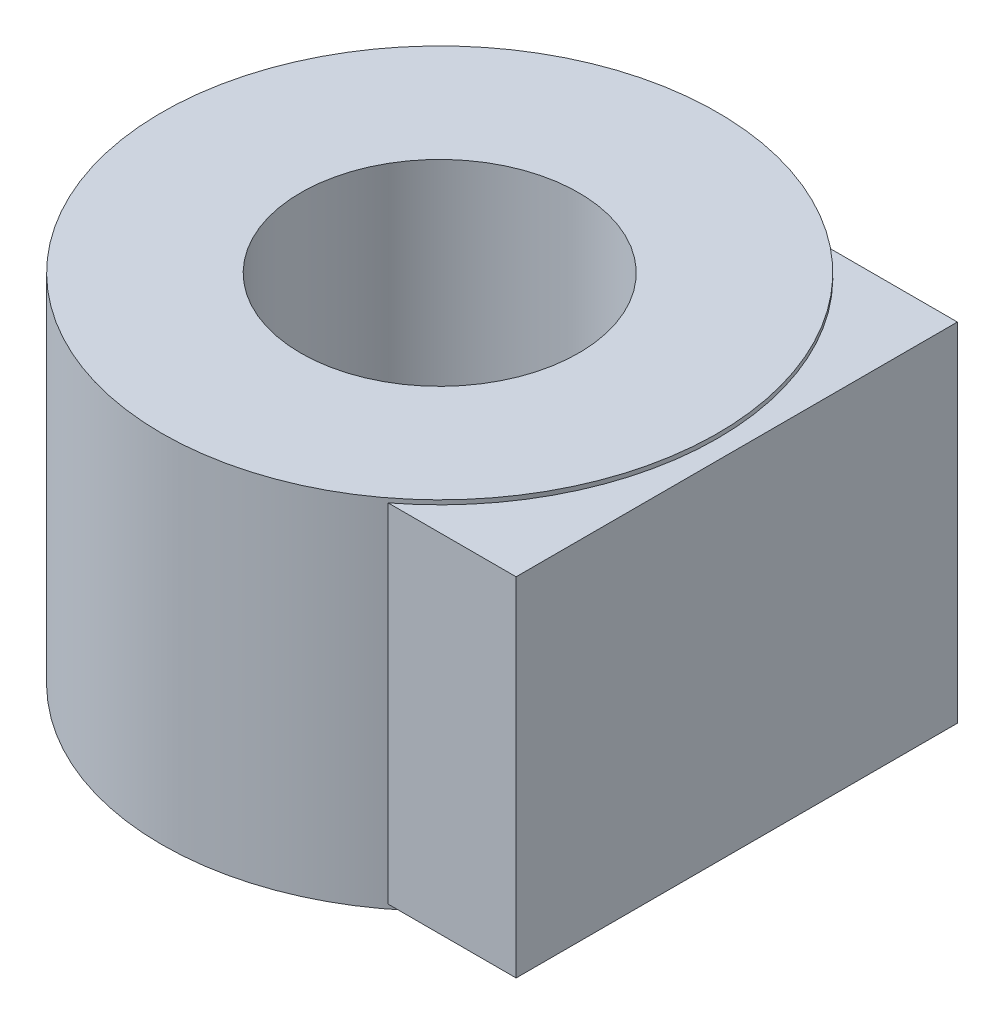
SolidWorks part; units mm, degrees
ref_plane "Front Plane" through (0, 0, 0) normal (0, 0, 1) x (1, 0, 0)
ref_plane "Top Plane" through (0, 0, 0) normal (0, 1, 0) x (1, 0, 0)
ref_plane "Right Plane" through (0, 0, 0) normal (1, 0, 0) x (0, 0, -1)
sketch "Sketch1" plane through (0, 0, 0) normal (0, 0, 1) x (1, 0, 0)
  line L1 (-18, -10) -> (18, -10)
  line L2 (-18, -10) -> (-18, 10)
  line L3 (-18, 10) -> (18, 10)
  line L4 (18, -10) -> (18, 10)
  line L5 (-18, -10) -> (18, 10) construction
  line L6 (-18, 10) -> (18, -10) construction
  point P0 (0, 0)
  dimension "D1" = 20
  dimension "D2" = 36
extrude "Boss-Extrude1" add sketch "Sketch1" along normal mid plane 25.4
sketch "Sketch2" plane through (0, 0, 0) normal (0, 1, 0) x (1, 0, 0)
  line L0 (-18, -12.7) -> (-18, 12.7) construction
  circle A0 centre (-18, 0) radius 16
  dimension "D1" = 32
extrude "Boss-Extrude2" add sketch "Sketch2" along normal mid plane 20.5
sketch "Sketch3" plane through (0, 10.25, 0) normal (0, 1, 0) x (1, 0, 0)
  line L0 (-18, 16) -> (-18, -16) construction
  line L1 (-34, 0) -> (-2, 0) construction
  circle A0 centre (-18, 0) radius 16 construction
  arc A1 (-8.2681, -12.7) -> (-8.2681, 12.7) centre (-18, 0) ccw construction
  circle A2 centre (-18, 0) radius 8
  dimension "D1" = 16
extrude "Cut-Extrude1" cut sketch "Sketch3" against normal blind 33
sketch "Sketch4" plane through (0, 10, 0) normal (0, 1, 0) x (1, 0, 0)
  line L0 (18, 12.7) -> (-8.2681, 12.7) construction
  line L1 (-0.902, 12.7) -> (-0.902, -12.7)
  line L2 (18, -12.7) -> (-8.2681, -12.7) construction
  line L3 (-0.902, -12.7) -> (18, -12.7)
  line L4 (18, -12.7) -> (18, 12.7)
  line L5 (18, -12.7) -> (18, 12.7) construction
  line L6 (18, 12.7) -> (-0.902, 12.7)
extrude "Cut-Extrude2" cut sketch "Sketch4" against normal through all
scale "Scale1" scale about centroid uniform scaling yes scale factor 0.7
scale "Scale2" scale about centroid uniform scaling yes scale factor 0.5
scale "Scale3" scale about centroid uniform scaling yes scale factor 1.25
